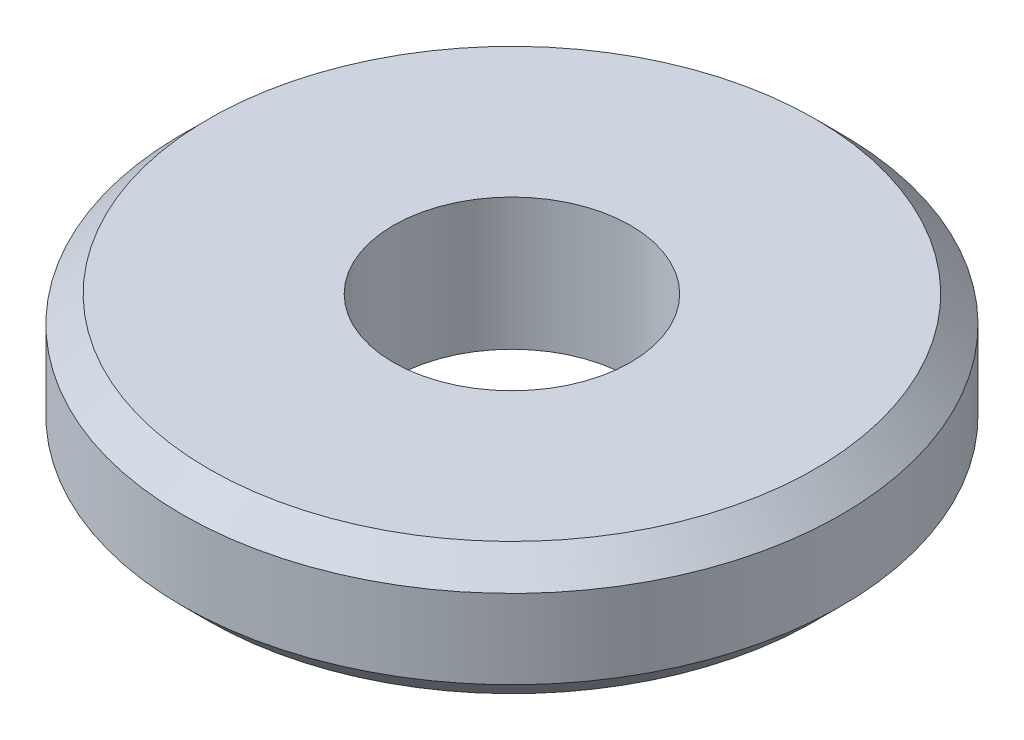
SolidWorks part; units mm, degrees
ref_plane "Front Plane" through (0, 0, 0) normal (0, 0, 1) x (1, 0, 0)
ref_plane "Top Plane" through (0, 0, 0) normal (0, 1, 0) x (1, 0, 0)
ref_plane "Right Plane" through (0, 0, 0) normal (1, 0, 0) x (0, 0, -1)
sketch "Sketch1" plane through (0, 0, 0) normal (0, 1, 0) x (1, 0, 0)
  circle A0 centre (0, 0) radius 12.5
  circle A1 centre (0, 0) radius 4.5
  dimension "D1" = 9
  dimension "D2" = 25
extrude "Extrude1" add sketch "Sketch1" along normal blind 5
chamfer "Chamfer1" distance 1 angle 45 2 edges at (0, 0, 12.5) (0, 5, 12.5)
